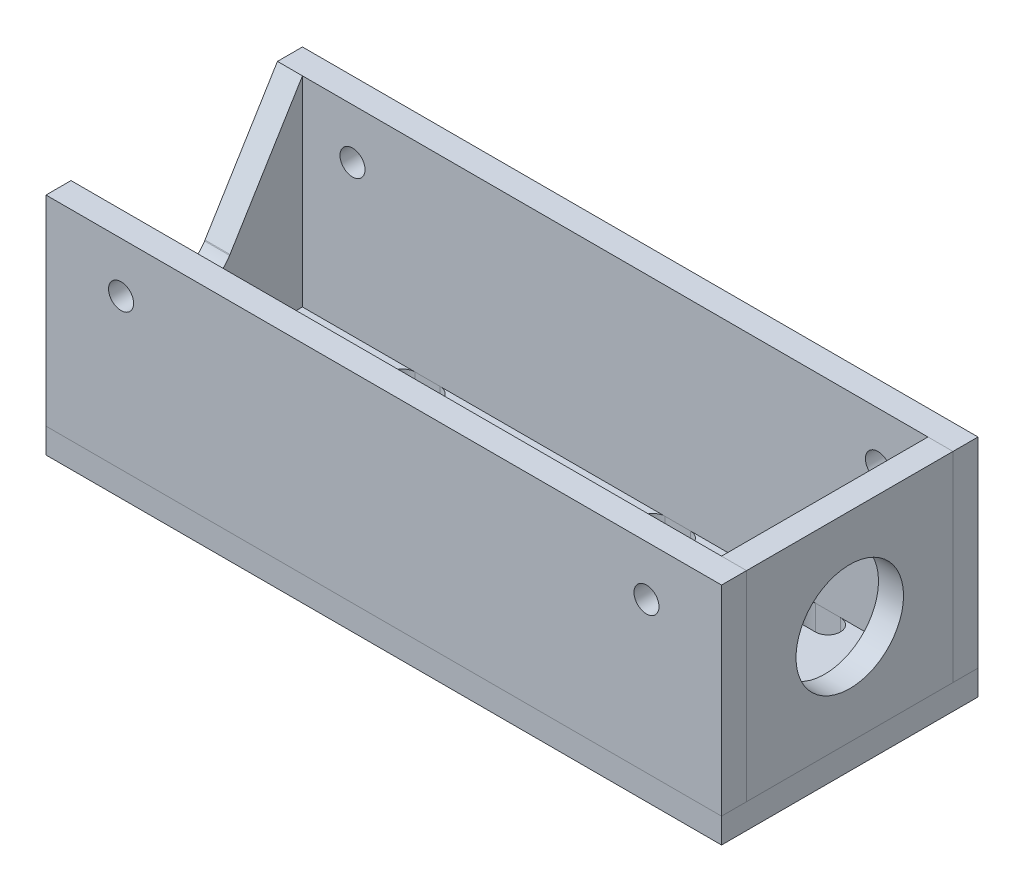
SolidWorks part; units mm, degrees
ref_plane "Front Plane" through (0, 0, 0) normal (0, 0, 1) x (1, 0, 0)
ref_plane "Top Plane" through (0, 0, 0) normal (0, 1, 0) x (1, 0, 0)
ref_plane "Right Plane" through (0, 0, 0) normal (1, 0, 0) x (0, 0, -1)
sketch "Sketch1" plane through (0, 0, 0) normal (0, 1, 0) x (1, 0, 0)
  line L0 (0, 52.3875) -> (-6.35, 52.3875) construction
  line L1 (0, 0) -> (158.75, 0) construction
  line L2 (0, 0) -> (0, 52.3875) construction
  line L3 (0, 52.3875) -> (158.75, 52.3875) construction
  line L4 (158.75, 0) -> (158.75, 52.3875) construction
  line L5 (-6.35, 52.3875) -> (-6.35, 0)
  line L6 (-6.35, 0) -> (0, 0) construction
  line L7 (158.75, 52.3875) -> (165.1, 52.3875) construction
  line L8 (165.1, 52.3875) -> (165.1, 0)
  line L9 (165.1, 0) -> (158.75, 0) construction
  line L10 (-6.35, 0) -> (-6.35, -6.35)
  line L11 (-6.35, -6.35) -> (165.1, -6.35)
  line L12 (165.1, -6.35) -> (165.1, 0)
  line L13 (165.1, 52.3875) -> (165.1, 58.7375)
  line L14 (165.1, 58.7375) -> (-6.35, 58.7375)
  line L15 (-6.35, 58.7375) -> (-6.35, 52.3875)
  dimension "D1" = 158.75
  dimension "D2" = 6.35
  dimension "D3" = 6.35
  dimension "D4" = 52.3875
  dimension "D5" = 6.35
  dimension "D6" = 6.35
extrude "Boss-Extrude1" add sketch "Sketch1" along normal blind 6.35
sketch "Sketch2" plane through (0, 6.35, 0) normal (0, 1, 0) x (1, 0, 0)
  line L0 (165.1, -6.35) -> (165.1, 58.7375) construction
  line L1 (-6.35, 58.7375) -> (165.1, 58.7375)
  line L2 (-6.35, 58.7375) -> (-6.35, 52.3875)
  line L3 (-6.35, 52.3875) -> (165.1, 52.3875)
  line L4 (165.1, 58.7375) -> (165.1, 52.3875)
  line L5 (-6.35, 58.7375) -> (-6.35, -6.35) construction
  line L6 (165.1, -6.35) -> (-6.35, -6.35)
  line L7 (165.1, -6.35) -> (165.1, 0)
  line L8 (165.1, 0) -> (-6.35, 0)
  line L9 (-6.35, -6.35) -> (-6.35, 0)
  dimension "D1" = 6.35
  dimension "D2" = 6.35
extrude "Boss-Extrude2" add sketch "Sketch2" along normal blind 50.8 separate body
sketch "Sketch3" plane through (0, 6.35, 0) normal (0, 1, 0) x (1, 0, 0)
  line L0 (-6.35, 52.3875) -> (165.1, 52.3875) construction
  line L1 (-6.35, 52.3875) -> (0, 52.3875)
  line L2 (-6.35, 52.3875) -> (-6.35, 0)
  line L3 (-6.35, 0) -> (0, 0)
  line L4 (0, 52.3875) -> (0, 0)
  line L5 (165.1, 0) -> (158.75, 0)
  line L6 (165.1, 0) -> (165.1, 52.3875)
  line L7 (165.1, 52.3875) -> (158.75, 52.3875)
  line L8 (158.75, 0) -> (158.75, 52.3875)
  dimension "D1" = 6.35
  dimension "D2" = 6.35
extrude "Boss-Extrude3" add sketch "Sketch3" along normal blind 50.8 separate body
sketch "Sketch4" plane through (-6.35, 0, 0) normal (-1, 0, 0) x (0, 0, 1)
  line L0 (-52.3875, 6.35) -> (0, 57.15) construction
  circle A0 centre (-26.1938, 31.75) radius 9.0957
  dimension "D1" = 18.1914
extrude "Cut-Extrude1" cut sketch "Sketch4" against normal blind 6.35
sketch "Sketch5" plane through (165.1, 0, 0) normal (1, 0, 0) x (0, 0, -1)
  line L0 (52.3875, 57.15) -> (0, 6.35) construction
  circle A0 centre (26.1938, 31.75) radius 13.6436
  dimension "D1" = 27.2871
extrude "Cut-Extrude2" cut sketch "Sketch5" against normal blind 6.35
sketch "Sketch6" plane through (0, 0, 6.35) normal (0, 0, 1) x (1, 0, 0)
  line L0 (-6.35, 57.15) -> (-6.35, 6.35) construction
  line L1 (-6.35, 57.15) -> (165.1, 57.15) construction
  line L3 (165.1, 57.15) -> (165.1, 6.35) construction
  circle A0 centre (12.7, 44.45) radius 3.175
  circle A1 centre (146.05, 44.45) radius 3.175
  dimension "D1" = 6.35
  dimension "D6" = 6.35
  dimension "D2" = 19.05
  dimension "D3" = 12.7
  dimension "D4" = 12.7
  dimension "D5" = 19.05
extrude "Cut-Extrude3" cut sketch "Sketch6" against normal blind 6.35
sketch "Sketch7" plane through (0, 0, -58.7375) normal (0, 0, -1) x (-1, 0, 0)
  line L0 (6.35, 57.15) -> (6.35, 6.35) construction
  line L1 (-165.1, 57.15) -> (6.35, 57.15) construction
  line L2 (-165.1, 57.15) -> (-165.1, 6.35) construction
  circle A0 centre (-12.7, 44.45) radius 3.175
  circle A1 centre (-146.05, 44.45) radius 3.175
  dimension "D3" = 6.35
  dimension "D6" = 6.35
  dimension "D1" = 19.05
  dimension "D2" = 12.7
  dimension "D4" = 19.05
  dimension "D5" = 12.7
extrude "Cut-Extrude4" cut sketch "Sketch7" against normal blind 6.35
sketch "Sketch8" plane through (-6.35, 0, 0) normal (-1, 0, 0) x (0, 0, 1)
  line L0 (-52.3875, 57.15) -> (0, 57.15)
  line L1 (-26.1937, 57.15) -> (-26.1938, 40.8457) construction
  line L2 (-18.5963, 26.7489) -> (0, 57.15)
  line L3 (-33.903, 26.9231) -> (-52.3875, 57.15)
  circle A0 centre (-26.1938, 31.75) radius 9.0957 construction
  circle A1 centre (-26.1938, 31.75) radius 9.0957 construction
  arc A2 (-33.903, 26.9231) -> (-18.5963, 26.7489) centre (-26.195, 31.6367) ccw
extrude "Cut-Extrude5" cut sketch "Sketch8" against normal blind 6.35
sketch "Sketch9" plane through (0, 6.35, 0) normal (0, 1, 0) x (1, 0, 0)
  line L0 (136.525, 3.175) -> (130.175, 3.175) construction
  line L1 (136.525, 0) -> (130.175, 0)
  line L2 (136.525, 6.35) -> (130.175, 6.35)
  line L3 (165.1, 0) -> (-6.35, 0) construction
  line L4 (158.75, 52.3875) -> (158.75, 0) construction
  line L5 (98.425, 3.175) -> (92.075, 3.175) construction
  line L6 (98.425, 0) -> (92.075, 0)
  line L7 (98.425, 6.35) -> (92.075, 6.35)
  line L8 (34.925, 3.175) -> (28.575, 3.175) construction
  line L9 (34.925, 0) -> (28.575, 0)
  line L10 (34.925, 6.35) -> (28.575, 6.35)
  line L11 (158.75, 0) -> (158.75, 52.3875) construction
  line L12 (-6.35, 52.3875) -> (165.1, 52.3875) construction
  line L13 (158.75, 26.1937) -> (126.2371, 26.1937) construction
  line L14 (136.525, 49.2125) -> (130.175, 49.2125) construction
  line L15 (136.525, 52.3875) -> (130.175, 52.3875)
  line L16 (136.525, 46.0375) -> (130.175, 46.0375)
  line L17 (98.425, 49.2125) -> (92.075, 49.2125) construction
  line L18 (98.425, 52.3875) -> (92.075, 52.3875)
  line L19 (98.425, 46.0375) -> (92.075, 46.0375)
  line L20 (34.925, 49.2125) -> (28.575, 49.2125) construction
  line L21 (34.925, 52.3875) -> (28.575, 52.3875)
  line L22 (34.925, 46.0375) -> (28.575, 46.0375)
  arc A0 (136.525, 0) -> (136.525, 6.35) centre (136.525, 3.175) ccw
  arc A1 (130.175, 6.35) -> (130.175, 0) centre (130.175, 3.175) ccw
  arc A2 (98.425, 0) -> (98.425, 6.35) centre (98.425, 3.175) ccw
  arc A3 (92.075, 6.35) -> (92.075, 0) centre (92.075, 3.175) ccw
  arc A4 (34.925, 0) -> (34.925, 6.35) centre (34.925, 3.175) ccw
  arc A5 (28.575, 6.35) -> (28.575, 0) centre (28.575, 3.175) ccw
  arc A6 (136.525, 52.3875) -> (136.525, 46.0375) centre (136.525, 49.2125) cw
  arc A7 (130.175, 46.0375) -> (130.175, 52.3875) centre (130.175, 49.2125) cw
  arc A8 (98.425, 52.3875) -> (98.425, 46.0375) centre (98.425, 49.2125) cw
  arc A9 (92.075, 46.0375) -> (92.075, 52.3875) centre (92.075, 49.2125) cw
  arc A10 (34.925, 52.3875) -> (34.925, 46.0375) centre (34.925, 49.2125) cw
  arc A11 (28.575, 46.0375) -> (28.575, 52.3875) centre (28.575, 49.2125) cw
  point P2 (133.35, 3.175)
  point P14 (95.25, 3.175)
  point P22 (31.75, 3.175)
  point P34 (133.35, 49.2125)
  point P41 (95.25, 49.2125)
  point P48 (31.75, 49.2125)
  dimension "D1" = 6.35
  dimension "D2" = 6.35
  dimension "D3" = 25.4
  dimension "D4" = 2
  dimension "D5" = 2
extrude "Cut-Extrude6" cut sketch "Sketch9" against normal blind 6.35
